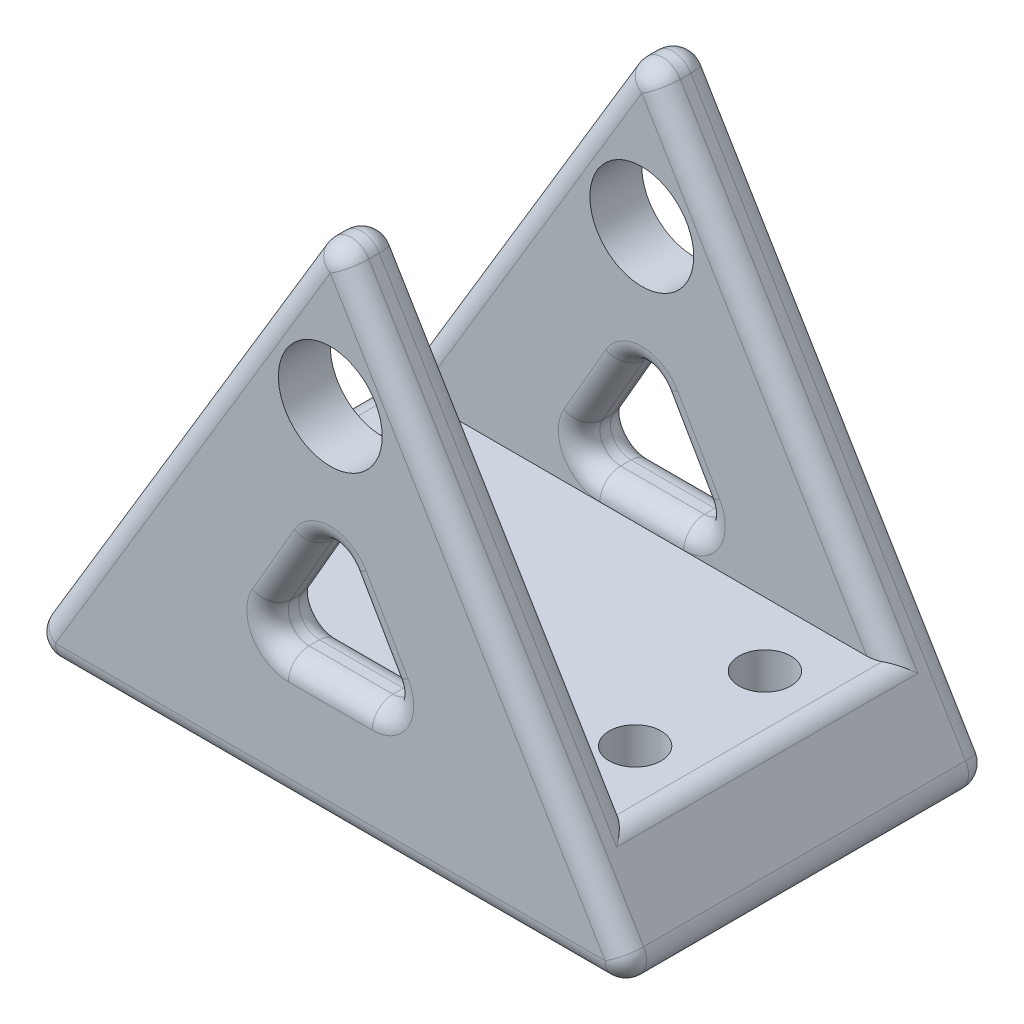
SolidWorks part; units mm, degrees
ref_plane "Front Plane" through (0, 0, 0) normal (0, 0, 1) x (1, 0, 0)
ref_plane "Top Plane" through (0, 0, 0) normal (0, 1, 0) x (1, 0, 0)
ref_plane "Right Plane" through (0, 0, 0) normal (1, 0, 0) x (0, 0, -1)
sketch "Sketch2" plane through (0, 0, 0) normal (0, 0, 1) x (1, 0, 0)
  line L1 (-38.1, 31.75) -> (38.1, 31.75)
  line L2 (-38.1, 31.75) -> (-38.1, -31.75)
  line L3 (-38.1, -31.75) -> (38.1, -31.75)
  line L4 (38.1, 31.75) -> (38.1, -31.75)
  line L5 (-38.1, 31.75) -> (38.1, -31.75) construction
  line L6 (-38.1, -31.75) -> (38.1, 31.75) construction
  point P0 (0, 0)
  dimension "D1" = 76.2
  dimension "D2" = 63.5
extrude "Boss-Extrude1" add sketch "Sketch2" along normal blind 44.45
sketch "Sketch3" plane through (0, 0, 44.45) normal (0, 0, 1) x (1, 0, 0)
  line L0 (0, 31.75) -> (0, -31.75) construction
  line L1 (-38.1, -31.75) -> (38.1, -31.75) construction
  line L2 (-38.1, -31.75) -> (0, 31.75)
  line L4 (-38.1, 31.75) -> (-38.1, -31.75)
  line L7 (-38.1, 31.75) -> (0, 31.75)
  point P6 (0, 0)
sketch "Sketch5" plane through (38.1, 0, 0) normal (1, 0, 0) x (0, 0, -1)
  line L0 (0, 0) -> (-44.45, 0) construction
  line L1 (-44.45, 0) -> (-22.225, 31.75) construction
  line L2 (-44.45, 31.75) -> (0, 31.75) construction
  line L3 (-22.225, 31.75) -> (-22.225, -31.75) construction
  line L4 (-44.45, -31.75) -> (0, -31.75) construction
  line L5 (-38.1, -19.05) -> (-6.35, -19.05)
  line L6 (-38.1, -19.05) -> (-38.1, 31.75)
  line L7 (-38.1, 31.75) -> (-6.35, 31.75)
  line L8 (-6.35, 31.75) -> (-6.35, -19.05)
  point P13 (-22.225, -19.05)
  dimension "D1" = 31.75
  dimension "D2" = 50.8
extrude "Cut-Extrude3" cut sketch "Sketch5" against normal through all
extrude "Cut-Extrude4" cut sketch "Sketch3" against normal blind 44.45
sketch "Sketch6" plane through (0, 0, 44.45) normal (0, 0, 1) x (1, 0, 0)
  line L0 (0, 31.75) -> (38.1, -31.75)
  line L1 (38.1, -31.75) -> (38.1, 31.75)
  line L2 (38.1, 31.75) -> (0, 31.75)
extrude "Cut-Extrude5" cut sketch "Sketch6" against normal through all
sketch "Sketch7" plane through (0, -19.05, 0) normal (0, 1, 0) x (1, 0, 0)
  line L0 (0, 0) -> (0, -44.1741) construction
  line L1 (-30.48, -22.087) -> (30.48, -22.087) construction
  line L2 (30.48, -38.1) -> (30.48, -6.35) construction
  line L3 (-30.48, -6.35) -> (-30.48, -38.1) construction
  circle A0 centre (-22.86, -14.1495) radius 3.175
  circle A1 centre (22.86, -14.1495) radius 3.175
  circle A2 centre (22.86, -30.0245) radius 3.175
  circle A3 centre (-22.86, -30.0245) radius 3.175
  point P9 (0, -22.087)
  dimension "D1" = 6.35
  dimension "D2" = 7.9375
  dimension "D3" = 7.62
extrude "Cut-Extrude6" cut sketch "Sketch7" against normal blind 44.45
sketch "Sketch8" plane through (0, 0, 44.45) normal (0, 0, 1) x (1, 0, 0)
  line L0 (0, 31.75) -> (0, -31.75) construction
  line L1 (-38.1, -31.75) -> (38.1, -31.75) construction
  line L3 (0, 0) -> (-9.525, -16.4978)
  line L4 (-9.525, -16.4978) -> (9.525, -16.4978)
  line L5 (9.525, -16.4978) -> (0, 0)
  circle A0 centre (0, 12.7) radius 6.35
  circle A1 centre (0, -10.9985) radius 5.4993 construction
  point P6 (0, 0)
  dimension "D1" = 12.7
  dimension "D2" = 19.05
  dimension "D3" = 19.05
  dimension "D4" = 12.7
extrude "Cut-Extrude7" cut sketch "Sketch8" against normal through all
fillet "Fillet1" radius 2.54 34 edges at (-4.7625, -8.2489, 38.1) (0, -16.4978, 38.1) (4.7625, -8.2489, 38.1) (19.05, 0, 44.45) (-19.05, 0, 0) (4.7625, -8.2489, 0) (-4.7625, -8.2489, 0) (0, -16.4978, 0) (19.05, 0, 0) (15.24, 6.35, 38.1) (30.48, -19.05, 22.225) (15.24, 6.35, 6.35) (-4.7625, -8.2489, 44.45) (4.7625, -8.2489, 44.45) (0, -16.4978, 44.45) (0, -16.4978, 6.35) (4.7625, -8.2489, 6.35) (-4.7625, -8.2489, 6.35) (-15.24, 6.35, 6.35) (-19.05, 0, 44.45) (-15.24, 6.35, 38.1) (-38.1, -31.75, 22.225) (-30.48, -19.05, 22.225) (0, -31.75, 0) (38.1, -31.75, 22.225) (0, -31.75, 44.45) (0, 31.75, 41.275) (0, 31.75, 3.175) (0, 0, 3.175) (9.525, -16.4978, 3.175) (-9.525, -16.4978, 3.175) (-9.525, -16.4978, 41.275) (9.525, -16.4978, 41.275) (0, 0, 41.275)
